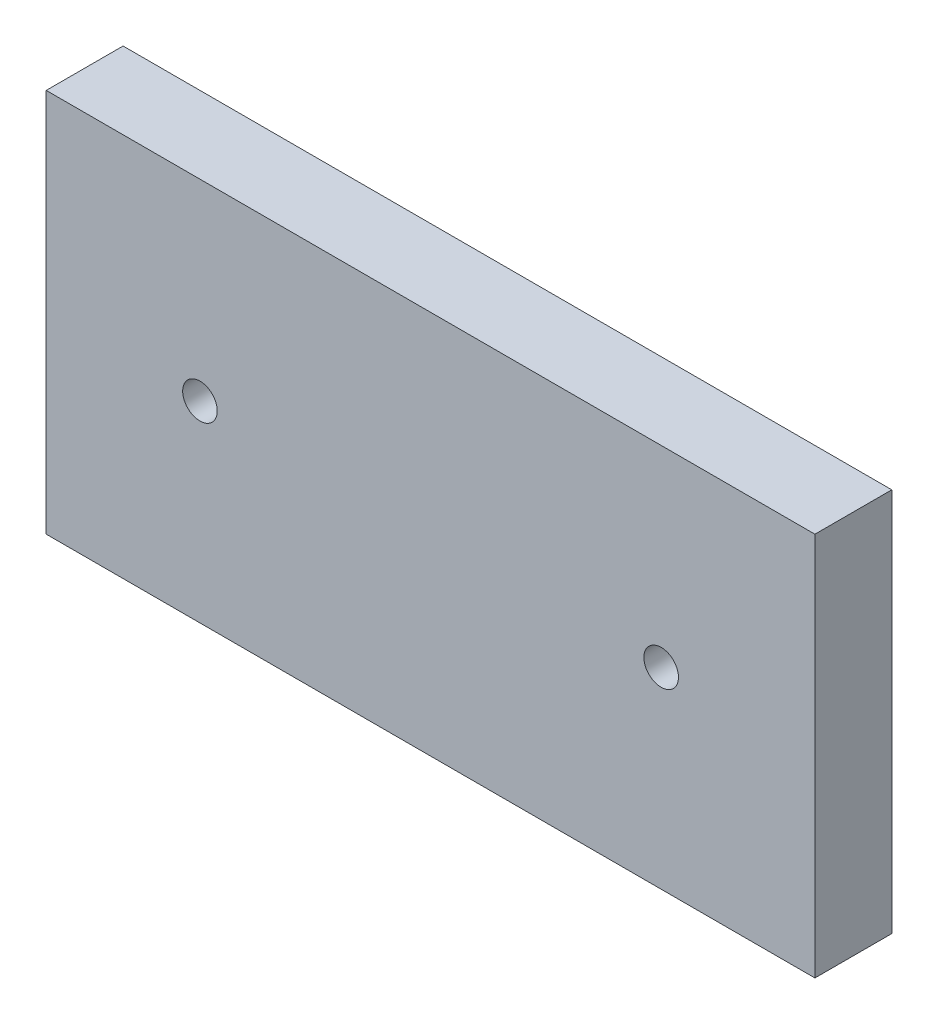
SolidWorks part; units mm, degrees
ref_plane "Plan de face" through (0, 0, 0) normal (0, 0, 1) x (1, 0, 0)
ref_plane "Plan de dessus" through (0, 0, 0) normal (0, 1, 0) x (1, 0, 0)
ref_plane "Plan de droite" through (0, 0, 0) normal (1, 0, 0) x (0, 0, -1)
sketch "Esquisse1" plane through (0, 0, 0) normal (0, 0, 1) x (1, 0, 0)
  line L1 (-50, 25) -> (50, 25)
  line L2 (-50, 25) -> (-50, -25)
  line L3 (-50, -25) -> (50, -25)
  line L4 (50, 25) -> (50, -25)
  dimension "D1" = 100
  dimension "D2" = 50
  dimension "D3" = 50
  dimension "D4" = 25
extrude "Boss.-Extru.1" add sketch "Esquisse1" along normal blind 10
sketch "Esquisse2" plane through (0, 0, 10) normal (0, 0, 1) x (1, 0, 0)
  line L0 (-56.0785, 0) -> (57.0538, 0) construction
  circle A0 centre (-30, 0) radius 2.25
  circle A1 centre (30, 0) radius 2.25
  dimension "D3" = 4.5
  dimension "D1" = 60
  dimension "D2" = 30
extrude "Enlèv. mat.-Extru.1" cut sketch "Esquisse2" against normal through all
